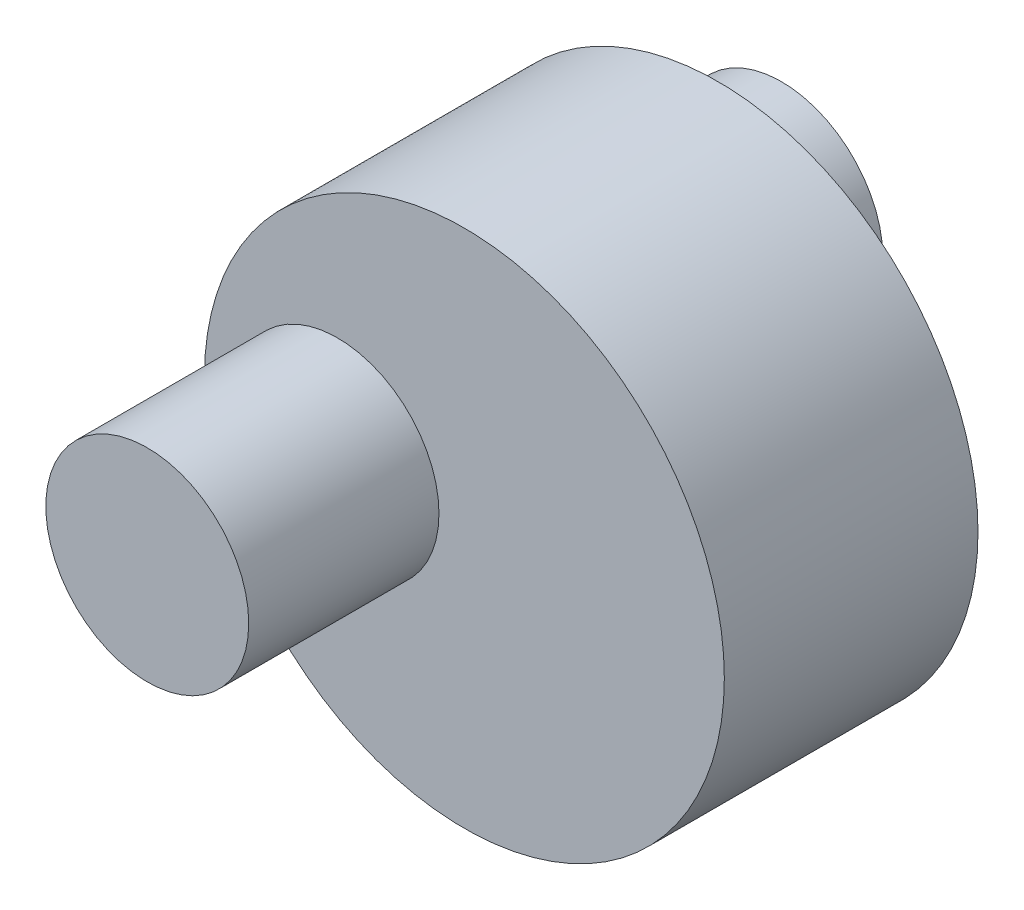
SolidWorks part; units mm, degrees
ref_plane "Plan1" through (0, 0, 0) normal (0, 0, 1) x (1, 0, 0)
ref_plane "Plan2" through (0, 0, 0) normal (0, 1, 0) x (1, 0, 0)
ref_plane "Plan3" through (0, 0, 0) normal (1, 0, 0) x (0, 0, -1)
sketch "Esquisse1" plane through (0, 0, 0) normal (0, 0, 1) x (1, 0, 0)
  circle A0 centre (0, 0) radius 8
  dimension "D1" = 16
extrude "Base-Extrusion" add sketch "Esquisse1" along normal mid plane 50
sketch "Esquisse2" plane through (0, 0, 0) normal (0, 0, 1) x (1, 0, 0)
  circle A0 centre (10, 0) radius 20.5
  dimension "D1" = 10
  dimension "D2" = 41
extrude "Boss.-Extru.1" add sketch "Esquisse2" along normal mid plane 20
sketch "Esquisse3" plane through (0, 0, 10) normal (0, 0, 1) x (1, 0, 0)
  line L0 (10, 0) -> (10, 20.5) construction
  line L1 (30.5, 0) -> (-10.5, 0) construction
  line L2 (10, 0) -> (10, -20.5) construction
  line L3 (-4.4957, 14.4957) -> (24.4957, -14.4957) construction
  line L5 (-4.4957, -14.4957) -> (24.4957, 14.4957) construction
  circle A0 centre (10, 0) radius 20.5 construction
  dimension "D3" = 45
  dimension "D1" = 45
